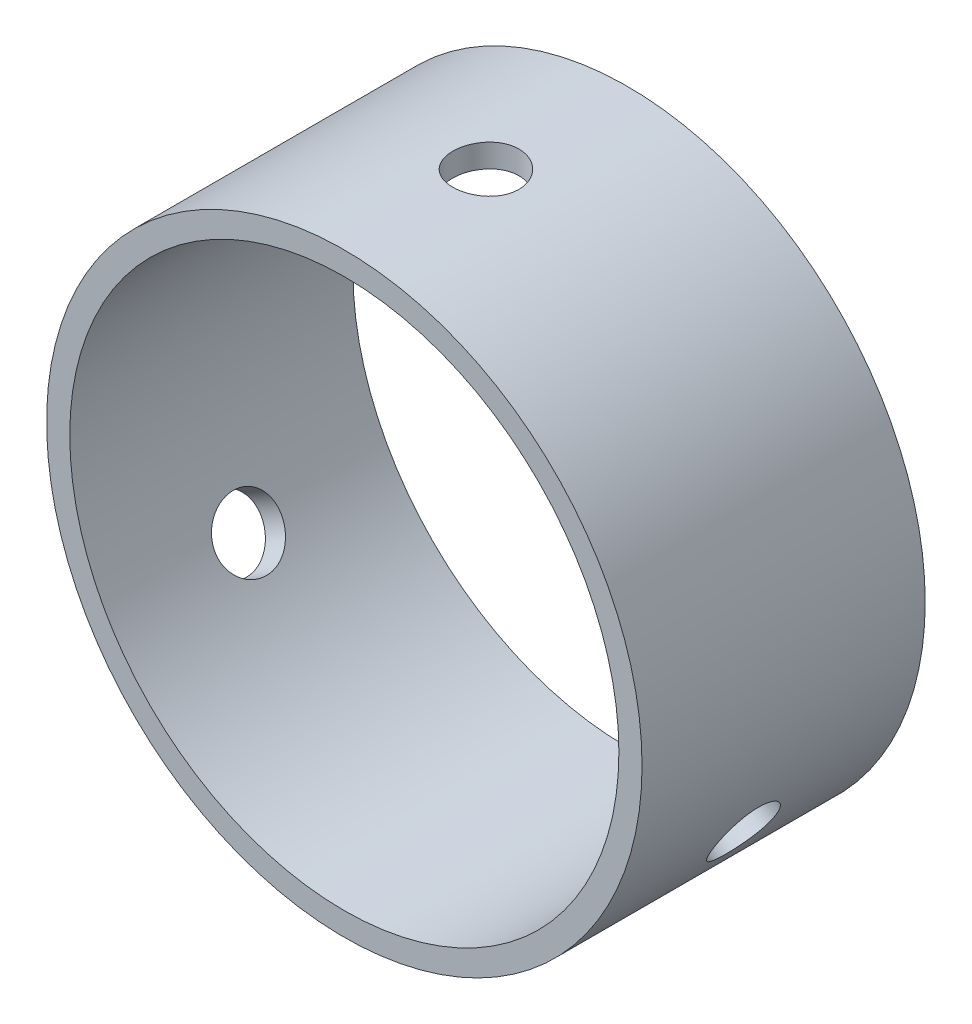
SolidWorks part; units mm, degrees
ref_plane "Front Plane" through (0, 0, 0) normal (0, 0, 1) x (1, 0, 0)
ref_plane "Top Plane" through (0, 0, 0) normal (0, 1, 0) x (1, 0, 0)
ref_plane "Right Plane" through (0, 0, 0) normal (1, 0, 0) x (0, 0, -1)
sketch "Sketch1" plane through (0, 0, 0) normal (0, 0, 1) x (1, 0, 0)
  circle A0 centre (0, 0) radius 57.15
  circle A1 centre (0, 0) radius 52.705
  dimension "D1" = 114.3
  dimension "D2" = 105.41
extrude "Extrude1" add sketch "Sketch1" along normal mid plane 54.356
ref_plane "Plane1" through (0, 57.15, 0) normal (0, 1, 0) x (-1, 0, 0)
sketch "Sketch2" plane through (0, 57.15, 0) normal (0, 1, 0) x (-1, 0, 0)
  circle A0 centre (0, 0) radius 6.35
  dimension "D1" = 12.7
extrude "Cut-Extrude1" cut sketch "Sketch2" against normal up to next
pattern_circular "CirPattern1" count 3 every 120 about axis through (0, 0, 27.178) along (0, 0, -1) of "Cut-Extrude1"
